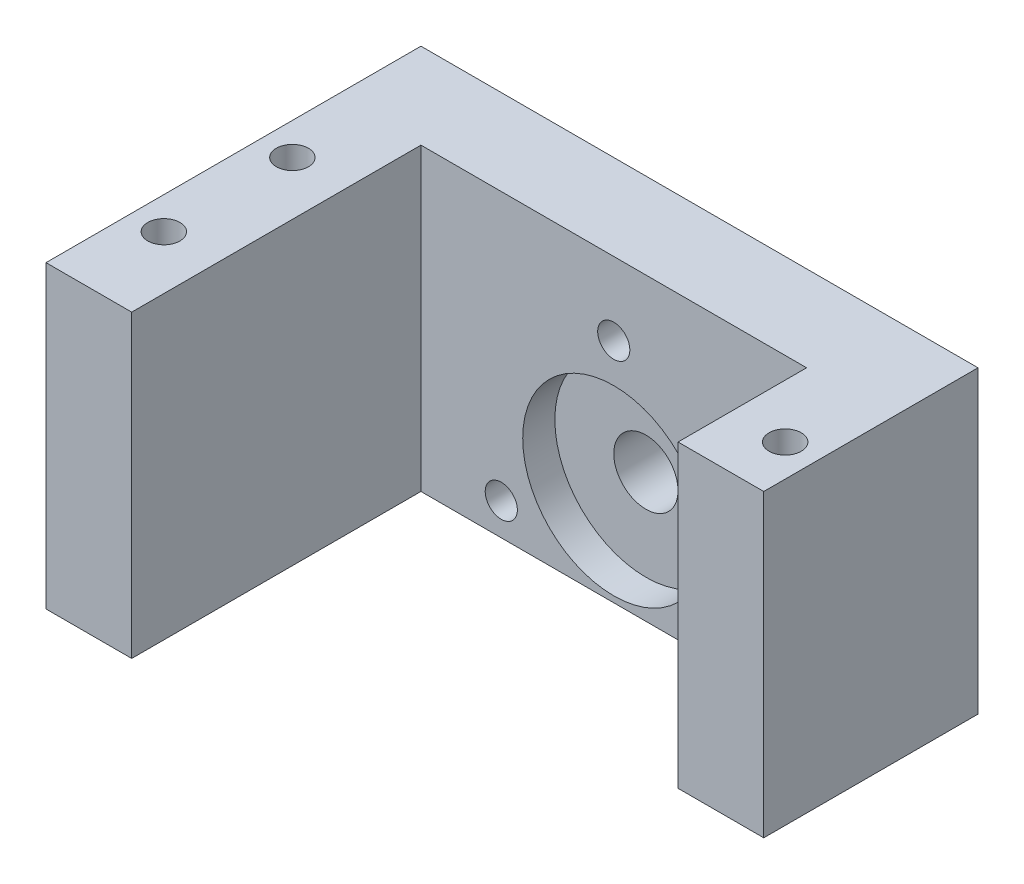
SolidWorks part; units mm, degrees
ref_plane "前视基准面" through (0, 0, 0) normal (0, 0, 1) x (1, 0, 0)
ref_plane "上视基准面" through (0, 0, 0) normal (0, 1, 0) x (1, 0, 0)
ref_plane "右视基准面" through (0, 0, 0) normal (1, 0, 0) x (0, 0, -1)
sketch "草图1" plane through (0, 0, 0) normal (0, 0, 1) x (1, 0, 0)
  line L0 (0, 14) -> (0, -14) construction
  line L1 (-18, 14) -> (18, 14)
  line L2 (-18, 14) -> (-18, -14)
  line L3 (-18, -14) -> (18, -14)
  line L4 (18, 14) -> (18, -14)
  line L5 (-18, 14) -> (18, -14) construction
  line L6 (-18, -14) -> (18, 14) construction
  line L7 (0, 7.1865) -> (-10.5, -11) construction
  line L8 (-10.5, -11) -> (10.5, -11) construction
  line L9 (10.5, -11) -> (0, 7.1865) construction
  line L10 (5.25, -1.9067) -> (-10.5, -11) construction
  circle A0 centre (-10.5, -11) radius 1.5
  circle A1 centre (0, 7.1865) radius 1.5
  circle A2 centre (10.5, -11) radius 1.5
  circle A3 centre (0, -4.9378) radius 8.5
  point P0 (0, 0)
  dimension "D3" = 3
  dimension "D4" = 10.5
  dimension "D5" = 3
  dimension "D6" = 21
  dimension "D7" = 3
  dimension "D8" = 17
  dimension "D1" = 28
  dimension "D2" = 36
extrude "凸台-拉伸1" add sketch "草图1" along normal blind 8
sketch "草图2" plane through (0, 0, 0) normal (0, 0, -1) x (-1, 0, 0)
  circle A0 centre (0, -4.9378) radius 8.5
  circle A1 centre (0, -4.9378) radius 3
  circle A2 centre (0, -4.9378) radius 8.5 construction
  dimension "D1" = 6
extrude "凸台-拉伸2" add sketch "草图2" against normal blind 5
sketch "草图3" plane through (0, 0, 0) normal (0, 0, -1) x (-1, 0, 0)
  line L0 (0, 14) -> (0, -14) construction
  line L1 (-18, 14) -> (18, 14) construction
  line L2 (18, -14) -> (-18, -14) construction
  line L3 (26, 14) -> (26, -14)
  line L4 (-18, 14) -> (-26, 14)
  line L5 (-18, 14) -> (-18, -14)
  line L6 (-18, -14) -> (-26, -14)
  line L7 (-26, 14) -> (-26, -14)
  line L8 (18, -14) -> (26, -14)
  line L9 (18, 14) -> (18, -14)
  line L10 (18, 14) -> (26, 14)
  dimension "D1" = 8
extrude "凸台-拉伸3" add sketch "草图3" against normal blind 35
sketch "草图4" plane through (0, 14, 0) normal (0, 1, 0) x (1, 0, 0)
  line L2 (26, 0) -> (-26, 0) construction
  line L3 (-26, -35) -> (-26, 0) construction
  line L4 (26, -35) -> (26, 0) construction
  circle A0 centre (-23, -15) radius 1.5
  circle A1 centre (-23, -27) radius 1.5
  circle A2 centre (23, -15) radius 1.5
  dimension "D1" = 3
  dimension "D2" = 3
  dimension "D3" = 3
  dimension "D4" = 15
  dimension "D5" = 12
  dimension "D6" = 15
  dimension "D7" = 3
  dimension "D8" = 3
extrude "切除-拉伸1" cut sketch "草图4" against normal blind 30
sketch "草图5" plane through (0, 14, 0) normal (0, 1, 0) x (1, 0, 0)
  line L0 (18, -35) -> (18, -8) construction
  line L1 (18, -20) -> (26, -20)
  line L2 (18, -20) -> (18, -35)
  line L3 (18, -35) -> (26, -35)
  line L4 (26, -20) -> (26, -35)
  dimension "D1" = 15
extrude "切除-拉伸2" cut sketch "草图5" against normal blind 45
